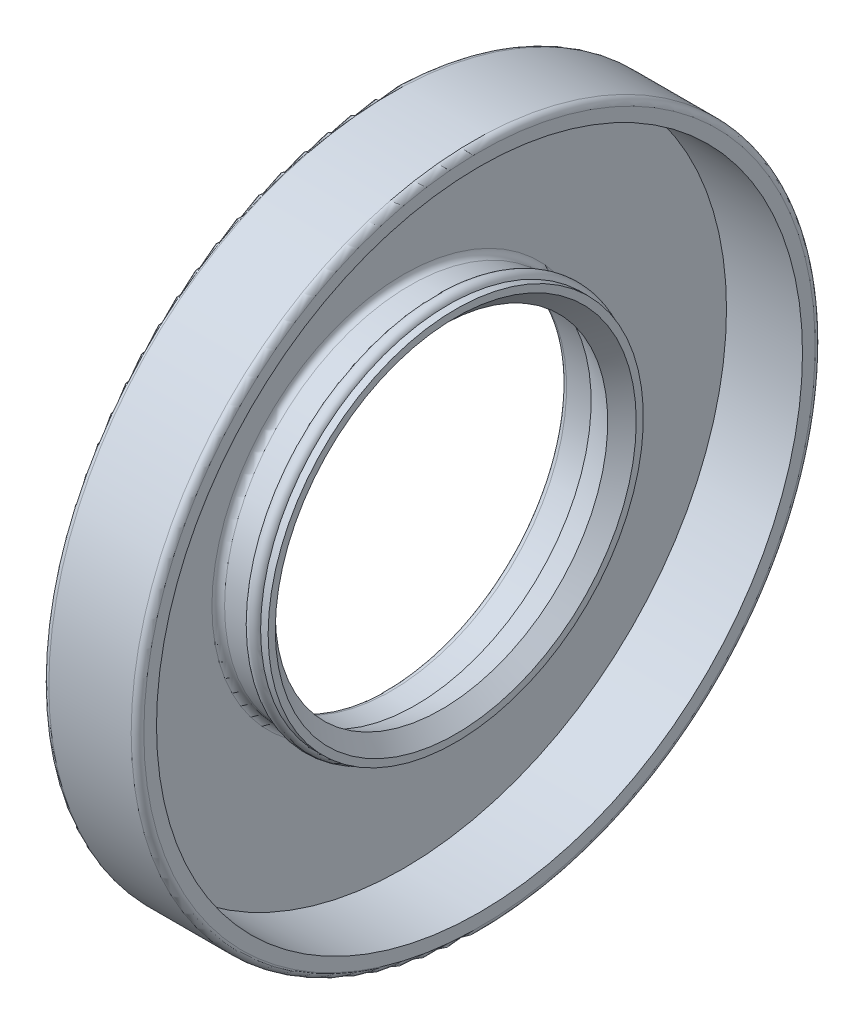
SolidWorks part; units mm, degrees
ref_plane "Plan1" through (0, 0, 0) normal (0, 0, 1) x (1, 0, 0)
ref_plane "Plan2" through (0, 0, 0) normal (0, 1, 0) x (1, 0, 0)
ref_plane "Plan3" through (0, 0, 0) normal (1, 0, 0) x (0, 0, -1)
sketch "Esquisse1" plane through (0, 0, 0) normal (0, 1, 0) x (1, 0, 0)
  line L0 (0, 0) -> (16.6667, 0) construction
  line L1 (0, 19.1667) -> (0, 35.3333)
  line L2 (0.6667, 36) -> (9.3333, 36)
  line L3 (10, 34) -> (2, 34)
  line L4 (2, 34) -> (2, 20.1667)
  line L10 (0.6667, 18.5) -> (3.2525, 18.5)
  line L12 (10, 34) -> (10, 35.3333)
  line L14 (3.2525, 18.5) -> (6, 17.5)
  line L15 (6, 17.5) -> (7.5, 19)
  line L16 (7.5, 19) -> (7.5, 19.75)
  line L17 (7.5, 19.75) -> (6.7071, 19.75)
  line L22 (2.6667, 19.5) -> (5.25, 19.5)
  arc A0 (0, 35.3333) -> (0.6667, 36) centre (0.6667, 35.3333) cw
  arc A1 (6.7071, 19.75) -> (5.25, 19.5) centre (6, 19.5) ccw
  arc A2 (9.3333, 36) -> (10, 35.3333) centre (9.3333, 35.3333) cw
  arc A3 (0, 19.1667) -> (0.6667, 18.5) centre (0.6667, 19.1667) ccw
  arc A4 (2.6667, 19.5) -> (2, 20.1667) centre (2.6667, 20.1667) cw
  point P13 (0, 36)
  point P22 (10, 36)
  dimension "r" = 0.6667
  dimension "l" = 1.5
  dimension "De" = 36
  dimension "b" = 10
  dimension "D7" = 45
  dimension "D6" = 20
  dimension "Di" = 17.5
  dimension "pl" = 7.5
  dimension "h" = 0.25
  dimension "ep" = 2
revolve "Base-Révolution" add sketch "Esquisse1" angle 360 about L0
equation "\"e@Esquisse1\" = \"b@Esquisse1\"/10"
equation "\"r@Esquisse1\"=\"e@Esquisse1\"*2/3"
equation "\"l@Esquisse1\"=\"e@Esquisse1\"*3/2"
equation "\"pl@Esquisse1\"=\"b@Esquisse1\"*3/4"
equation "\"h@Esquisse1\"=\"e@Esquisse1\"/4"
equation "\"ep@Esquisse1\"=\"e@Esquisse1\"*2"
